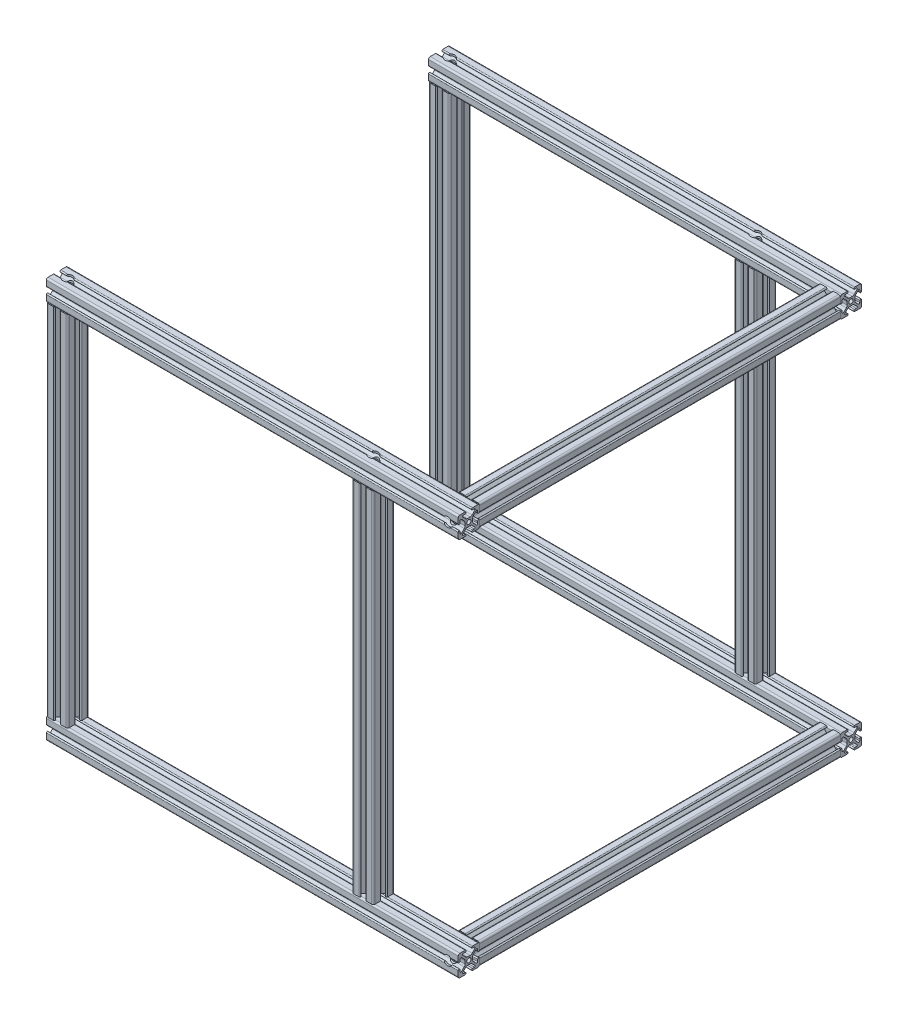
SolidWorks part; units mm, degrees
ref_plane "Front" through (0, 0, 0) normal (0, 0, 1) x (1, 0, 0)
ref_plane "Top" through (0, 0, 0) normal (0, 1, 0) x (1, 0, 0)
ref_plane "Right" through (0, 0, 0) normal (1, 0, 0) x (0, 0, -1)
sketch3d "Skeleton"
  line L0 (0, 0, 0) -> (0, 0, -450) construction
  line L1 (0, 0, -450) -> (460, 0, -450) construction
  line L2 (0, 0, 0) -> (460, 0, 0) construction
  line L3 (460, 0, 0) -> (460, 0, -450) construction
  line L4 (0, 0, 0) -> (0, 447, 0) construction
  line L5 (0, 0, -450) -> (0, 447, -450) construction
  line L6 (460, 0, -450) -> (460, 447, -450) construction
  line L7 (460, 0, 0) -> (460, 447, 0) construction
  line L8 (460, 447, 0) -> (0, 447, 0) construction
  line L9 (0, 447, 0) -> (0, 447, -450) construction
  line L10 (0, 447, -450) -> (460, 447, -450) construction
  line L11 (460, 447, -450) -> (460, 447, 0) construction
  line L12 (0, 203.594, 0) -> (0, 203.594, -450) construction
  line L13 (360, 447, 0) -> (360, 0, 0) construction
  line L14 (360, 0, 0) -> (360, 0, -450) construction
  line L15 (360, 0, -450) -> (360, 447, -450) construction
  line L16 (360, 447, -450) -> (360, 447, 0) construction
  line L17 (360, 203.594, 0) -> (360, 203.594, -450) construction
  dimension "D1" = 450
  dimension "D2" = 460
  dimension "D3" = 447
  dimension "D4" = 360
  dimension "D5" = 203.594
sketch3d "3DSketch3"
  line L8 (0, 447, 0) -> (0, 0, 0)
  line L9 (0, 0, 0) -> (0, 447, 0) construction
  line L14 (0, 447, -450) -> (0, 0, -450)
  line L15 (0, 0, -450) -> (0, 447, -450) construction
  line L16 (360, 447, 0) -> (360, 0, 0)
  line L17 (360, 447, 0) -> (360, 0, 0) construction
  line L18 (360, 447, -450) -> (360, 0, -450)
  line L19 (360, 0, -450) -> (360, 447, -450) construction
  line L20 (0, 447, 0) -> (460, 447, 0)
  line L21 (460, 447, 0) -> (0, 447, 0) construction
  line L22 (0, 447, -450) -> (460, 447, -450)
  line L23 (0, 447, -450) -> (460, 447, -450) construction
  line L24 (0, 447, 0) -> (0, 447, -450)
  line L25 (0, 447, 0) -> (0, 447, -450) construction
  line L26 (360, 447, 0) -> (360, 447, -450)
  line L27 (360, 447, -450) -> (360, 447, 0) construction
  line L28 (0, 0, 0) -> (460, 0, 0)
  line L29 (0, 0, 0) -> (460, 0, 0) construction
  line L30 (0, 0, -450) -> (460, 0, -450)
  line L31 (0, 0, -450) -> (460, 0, -450) construction
  line L34 (460, 0, 0) -> (460, 447, 0)
  line L36 (460, 0, -450) -> (460, 0, 0)
  line L37 (0, 203.594, 0) -> (0, 203.594, -450)
  line L38 (460, 0, -450) -> (460, 447, -450)
  line L39 (460, 0, 0) -> (460, 0, -450) construction
  line L40 (460, 447, -450) -> (460, 447, 0) construction
  line L41 (360, 0, 0) -> (360, 0, -450)
  line L42 (460, 447, 0) -> (460, 447, -450)
  line L43 (460, 0, 0) -> (460, 447, 0) construction
  line L44 (460, 0, -450) -> (460, 447, -450) construction
  line L45 (360, 203.594, 0) -> (360, 203.594, -450)
  point P2 (360, 447, -225)
  point P3 (360, 447, -225)
  point P5 (230, 0, 0)
  point P7 (230, 0, 0)
  point P10 (230, 0, -450)
  point P11 (230, 0, -450)
  point P13 (230, 447, 0)
  point P22 (230, 447, -450)
  point P43 (460, 447, -225)
  point P46 (460, 0, -225)
  point P47 (460, 0, -225)
  point P54 (0, 447, -225)
  point P55 (0, 447, -225)
  point P66 (230, 447, 0)
  point P69 (230, 447, -450)
  point P77 (460, 447, -225)
other "Metric 2525-25(1)"
ref_plane "Plane2" through (0, 447, 0) normal (0, -1, 0) x (1, 0, 0)
sketch "Sketch1" plane through (0, 447, 0) normal (0, -1, 0) x (1, 0, 0)
  line L0 (-12.5, 10.5371) -> (-12.5, 4.32)
  line L1 (-10.36, 4.32) -> (-10.36, 6.3969)
  line L2 (-8.6363, 7.1116) -> (-5.4322, 3.9121)
  line L3 (-4.455, 1.5554) -> (-4.455, -1.5554)
  line L4 (-5.4322, -3.9121) -> (-8.6363, -7.1116)
  line L5 (-10.36, -6.3969) -> (-10.36, -4.32)
  line L6 (-12.5, -4.32) -> (-12.5, -10.5371)
  line L7 (-10.5371, -12.5) -> (-4.3879, -12.5)
  line L8 (-4.3879, -10.36) -> (-6.42, -10.36)
  line L9 (-7.1337, -8.6353) -> (-3.7953, -5.3018)
  line L10 (-1.5554, -4.375) -> (1.5554, -4.375)
  line L11 (3.7953, -5.3018) -> (7.1337, -8.6353)
  line L12 (6.42, -10.36) -> (4.3879, -10.36)
  line L13 (4.3879, -12.5) -> (10.5371, -12.5)
  line L14 (12.5, -10.5371) -> (12.5, -4.32)
  line L15 (10.36, -4.32) -> (10.36, -6.3969)
  line L16 (8.6363, -7.1116) -> (5.4322, -3.9121)
  line L17 (4.455, -1.5554) -> (4.455, 1.5554)
  line L18 (5.4322, 3.9121) -> (8.6363, 7.1116)
  line L19 (10.36, 6.3969) -> (10.36, 4.32)
  line L20 (12.5, 4.32) -> (12.5, 10.5371)
  line L21 (10.5371, 12.5) -> (4.32, 12.5)
  line L22 (4.32, 10.36) -> (6.42, 10.36)
  line L23 (7.1337, 8.6353) -> (3.7953, 5.3018)
  line L24 (1.5554, 4.375) -> (-1.5554, 4.375)
  line L25 (-3.7953, 5.3018) -> (-7.1337, 8.6353)
  line L26 (-6.42, 10.36) -> (-4.32, 10.36)
  line L27 (-4.32, 12.5) -> (-10.5371, 12.5)
  line L28 (0, 12.5) -> (0, -12.5) construction
  line L30 (-12.5, 0) -> (12.5, 0) construction
  circle A0 centre (0, 0) radius 2.5
  arc A1 (-12.5, 4.32) -> (-10.36, 4.32) centre (-11.43, 4.32) ccw
  arc A2 (-8.6363, 7.1116) -> (-10.36, 6.3969) centre (-9.35, 6.3969) ccw
  arc A3 (-4.455, 1.5554) -> (-5.4322, 3.9121) centre (-7.7855, 1.5554) ccw
  arc A4 (-5.4322, -3.9121) -> (-4.455, -1.5554) centre (-7.7855, -1.5554) ccw
  arc A5 (-10.36, -6.3969) -> (-8.6363, -7.1116) centre (-9.35, -6.3969) ccw
  arc A6 (-10.36, -4.32) -> (-12.5, -4.32) centre (-11.43, -4.32) ccw
  arc A7 (-12.5, -10.5371) -> (-10.5371, -12.5) centre (-10.5371, -10.5371) ccw
  arc A8 (-4.3879, -12.5) -> (-4.3879, -10.36) centre (-4.3879, -11.43) ccw
  arc A9 (-7.1337, -8.6353) -> (-6.42, -10.36) centre (-6.42, -9.35) ccw
  arc A10 (-1.5554, -4.375) -> (-3.7953, -5.3018) centre (-1.5554, -7.545) ccw
  arc A11 (3.7953, -5.3018) -> (1.5554, -4.375) centre (1.5554, -7.545) ccw
  arc A12 (6.42, -10.36) -> (7.1337, -8.6353) centre (6.42, -9.35) ccw
  arc A13 (4.3879, -10.36) -> (4.3879, -12.5) centre (4.3879, -11.43) ccw
  arc A14 (10.5371, -12.5) -> (12.5, -10.5371) centre (10.5371, -10.5371) ccw
  arc A15 (12.5, -4.32) -> (10.36, -4.32) centre (11.43, -4.32) ccw
  arc A16 (8.6363, -7.1116) -> (10.36, -6.3969) centre (9.35, -6.3969) ccw
  arc A17 (4.455, -1.5554) -> (5.4322, -3.9121) centre (7.7855, -1.5554) ccw
  arc A18 (5.4322, 3.9121) -> (4.455, 1.5554) centre (7.7855, 1.5554) ccw
  arc A19 (10.36, 6.3969) -> (8.6363, 7.1116) centre (9.35, 6.3969) ccw
  arc A20 (10.36, 4.32) -> (12.5, 4.32) centre (11.43, 4.32) ccw
  arc A21 (12.5, 10.5371) -> (10.5371, 12.5) centre (10.5371, 10.5371) ccw
  arc A22 (4.32, 12.5) -> (4.32, 10.36) centre (4.32, 11.43) ccw
  arc A23 (7.1337, 8.6353) -> (6.42, 10.36) centre (6.42, 9.35) ccw
  arc A24 (1.5554, 4.375) -> (3.7953, 5.3018) centre (1.5554, 7.545) ccw
  arc A25 (-3.7953, 5.3018) -> (-1.5554, 4.375) centre (-1.5554, 7.545) ccw
  arc A26 (-6.42, 10.36) -> (-7.1337, 8.6353) centre (-6.42, 9.35) ccw
  arc A27 (-4.32, 10.36) -> (-4.32, 12.5) centre (-4.32, 11.43) ccw
  arc A28 (-10.5371, 12.5) -> (-12.5, 10.5371) centre (-10.5371, 10.5371) ccw
  point P86 (-12.5, 12.5)
  point P88 (12.5, 12.5)
  point P89 (12.5, -12.5)
  point P90 (-12.5, -12.5)
  point P91 (0, 0)
  dimension "D1" = 5
ref_plane "Plane3" through (0, 0, -225) normal (0, 0, 1) x (1, 0, 0)
hole_wizard "CBORE for M6 SHCS1" positions "Sketch2" profile "Sketch3" counterbore size "M6" standard "ANSI Metric"
sketch "Sketch2" plane through (0, 459.5, 0) normal (0, 1, 0) x (1, 0, 0)
  point P3 (0, 0)
  point P6 (0, 450)
  point P9 (360, 450)
  point P12 (360, 0)
sketch "Sketch3" plane through (0, 459.5, 0) normal (1, 0, 0) x (0, 0, 1)
  line L0 (0, 0) -> (0, 472)
  line L1 (0, 472) -> (3.3, 472)
  line L3 (3.3, 472) -> (3.3, 8)
  line L4 (3.3, 8) -> (5.5, 8)
  line L5 (5.5, 8) -> (5.5, 0)
  line L7 (5.5, 0) -> (0, 0)
  line L11 (0, -6.35) -> (0, 107.95) construction
  dimension "Thru Hole Dia." = 6.6
  dimension "Thru Hole Depth" = 472
  dimension "C'Bore Dia." = 11
  dimension "C'Bore Depth" = 8
hole_wizard "CBORE for M6 SHCS2" positions "Sketch4" profile "Sketch5" counterbore size "M6" standard "ANSI Metric"
sketch "Sketch4" plane through (0, -12.5, 0) normal (0, -1, 0) x (-1, 0, 0)
  point P0 (-360, 450)
  point P3 (0, 450)
  point P6 (-360, 0)
  point P9 (0, 0)
sketch "Sketch5" plane through (360, -12.5, -450) normal (1, 0, 0) x (0, 0, -1)
  line L0 (0, 0) -> (0, 472)
  line L1 (0, 472) -> (3.3, 472)
  line L3 (3.3, 472) -> (3.3, 8)
  line L4 (3.3, 8) -> (5.5, 8)
  line L5 (5.5, 8) -> (5.5, 0)
  line L7 (5.5, 0) -> (0, 0)
  line L11 (0, -6.35) -> (0, 107.95) construction
  dimension "Thru Hole Dia." = 6.6
  dimension "Thru Hole Depth" = 472
  dimension "C'Bore Dia." = 11
  dimension "C'Bore Depth" = 8
hole_wizard "CBORE for M6 SHCS3" positions "Sketch6" profile "Sketch7" counterbore size "M6" standard "ANSI Metric"
sketch "Sketch6" plane through (0, 0, -462.5) normal (0, 0, -1) x (-1, 0, 0)
  point P0 (-460, 447)
  point P3 (-460, 0)
sketch "Sketch7" plane through (460, 447, -462.5) normal (1, 0, 0) x (0, 1, 0)
  line L0 (0, 0) -> (0, 475)
  line L1 (0, 475) -> (3.3, 475)
  line L3 (3.3, 475) -> (3.3, 8)
  line L4 (3.3, 8) -> (5.5, 8)
  line L5 (5.5, 8) -> (5.5, 0)
  line L7 (5.5, 0) -> (0, 0)
  line L11 (0, -6.35) -> (0, 107.95) construction
  dimension "Thru Hole Dia." = 6.6
  dimension "Thru Hole Depth" = 475
  dimension "C'Bore Dia." = 11
  dimension "C'Bore Depth" = 8
hole_wizard "CBORE for M6 SHCS4" positions "Sketch8" profile "Sketch9" counterbore size "M6" standard "ANSI Metric"
sketch "Sketch8" plane through (0, 0, 12.5) normal (0, 0, 1) x (1, 0, 0)
  point P0 (460, 447)
  point P3 (460, 0)
sketch "Sketch9" plane through (460, 447, 12.5) normal (1, 0, 0) x (0, -1, 0)
  line L0 (0, 0) -> (0, 475)
  line L1 (0, 475) -> (3.3, 475)
  line L3 (3.3, 475) -> (3.3, 8)
  line L4 (3.3, 8) -> (5.5, 8)
  line L5 (5.5, 8) -> (5.5, 0)
  line L7 (5.5, 0) -> (0, 0)
  line L11 (0, -6.35) -> (0, 107.95) construction
  dimension "Thru Hole Dia." = 6.6
  dimension "Thru Hole Depth" = 475
  dimension "C'Bore Dia." = 11
  dimension "C'Bore Depth" = 8
delete or keep bodies "Body-Delete/Keep 1" [suppressed] type keep bodies bodies 142
hole_wizard "CBORE for M6 SHCS5" positions "Sketch10" profile "Sketch11" counterbore size "M6" standard "ANSI Metric"
sketch "Sketch10" plane through (0, 0, -12.5) normal (0, 0, -1) x (-1, 0, 0)
  point P0 (-460, 446.6)
sketch "Sketch11" plane through (460, 446.6, -12.5) normal (1, 0, 0) x (0, 1, 0)
  line L0 (0, 0) -> (0, 25)
  line L1 (0, 25) -> (3.3, 25)
  line L3 (3.3, 25) -> (3.3, 8)
  line L4 (3.3, 8) -> (5.5, 8)
  line L5 (5.5, 8) -> (5.5, 0)
  line L7 (5.5, 0) -> (0, 0)
  line L11 (0, -6.35) -> (0, 107.95) construction
  dimension "Thru Hole Dia." = 6.6
  dimension "Thru Hole Depth" = 25
  dimension "C'Bore Dia." = 11
  dimension "C'Bore Depth" = 8
delete or keep bodies "Body-Delete/Keep 2" [suppressed] type keep bodies bodies 118
delete or keep bodies "Body-Delete/Keep 3" [suppressed] type keep bodies bodies 104
